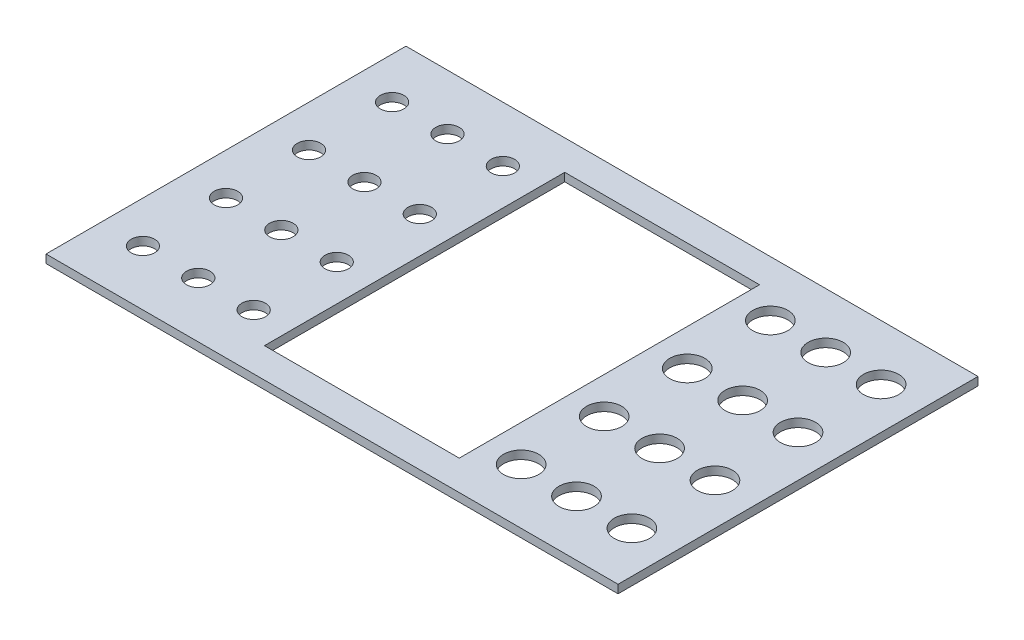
SolidWorks part; units mm, degrees
ref_plane "Front Plane" through (0, 0, 0) normal (0, 0, 1) x (1, 0, 0)
ref_plane "Top Plane" through (0, 0, 0) normal (0, 1, 0) x (1, 0, 0)
ref_plane "Right Plane" through (0, 0, 0) normal (1, 0, 0) x (0, 0, -1)
sketch "Sketch3" plane through (0, 0, 0) normal (0, 1, 0) x (1, 0, 0)
  line L1 (-206.6, -130) -> (206.6, -130)
  line L2 (-206.6, -130) -> (-206.6, 130)
  line L3 (-206.6, 130) -> (206.6, 130)
  line L4 (206.6, -130) -> (206.6, 130)
  line L5 (-206.6, -130) -> (206.6, 130) construction
  line L6 (-206.6, 130) -> (206.6, -130) construction
  point P0 (0, 0)
  dimension "D1" = 413.2
  dimension "D2" = 260
extrude "Boss-Extrude2" add sketch "Sketch3" along normal blind 6
sketch "Sketch4" plane through (0, 6, 0) normal (0, 1, 0) x (1, 0, 0)
  line L0 (206.6, 130) -> (-206.6, 130) construction
  line L1 (-206.6, -130) -> (206.6, -130) construction
  line L2 (-206.6, 130) -> (-206.6, -130) construction
  line L4 (206.6, -130) -> (206.6, 130) construction
  circle A0 centre (-176.6, 90) radius 8.5
  circle A1 centre (-136.6, 90) radius 8.5
  circle A2 centre (-96.6, 90) radius 8.5
  circle A3 centre (-136.6, 30) radius 8.5
  circle A4 centre (-96.6, 30) radius 8.5
  circle A5 centre (-136.6, -30) radius 8.5
  circle A6 centre (-96.6, -30) radius 8.5
  circle A7 centre (-136.6, -90) radius 8.5
  circle A8 centre (-96.6, -90) radius 8.5
  circle A9 centre (-176.6, 30) radius 8.5
  circle A10 centre (-176.6, -30) radius 8.5
  circle A11 centre (-176.6, -90) radius 8.5
  circle A24 centre (176.6, 90) radius 12.7
  circle A25 centre (136.6, 90) radius 12.7
  circle A26 centre (136.6, 30) radius 12.7
  circle A27 centre (136.6, -30) radius 12.7
  circle A28 centre (136.6, -90) radius 12.7
  circle A29 centre (176.6, 30) radius 12.7
  circle A30 centre (176.6, -30) radius 12.7
  circle A31 centre (176.6, -90) radius 12.7
  circle A32 centre (96.6, 90) radius 12.7
  circle A33 centre (96.6, 30) radius 12.7
  circle A34 centre (96.6, -30) radius 12.7
  circle A35 centre (96.6, -90) radius 12.7
  dimension "D1" = 17
  dimension "D4" = 40
  dimension "D5" = 40
  dimension "D6" = 30
  dimension "D7" = 30
  dimension "D8" = 40
  dimension "D9" = 30
  dimension "D10" = 25.4
  dimension "D11" = 2
  dimension "D13" = 40
  dimension "D14" = 40
  dimension "D2" = 3
  dimension "D3" = 4
  dimension "D12" = 4
  dimension "D15" = 2
extrude "Cut-Extrude1" cut sketch "Sketch4" against normal blind 10
sketch "Sketch5" plane through (0, 6, 0) normal (0, 1, 0) x (1, 0, 0)
  line L1 (-70.35, 108.45) -> (70.35, 108.45)
  line L2 (-70.35, 108.45) -> (-70.35, -108.45)
  line L3 (-70.35, -108.45) -> (70.35, -108.45)
  line L4 (70.35, 108.45) -> (70.35, -108.45)
  line L5 (-70.35, 108.45) -> (70.35, -108.45) construction
  line L6 (-70.35, -108.45) -> (70.35, 108.45) construction
  point P0 (0, 0)
  dimension "D1" = 140.7
  dimension "D2" = 216.9
extrude "Cut-Extrude2" cut sketch "Sketch5" against normal blind 10
